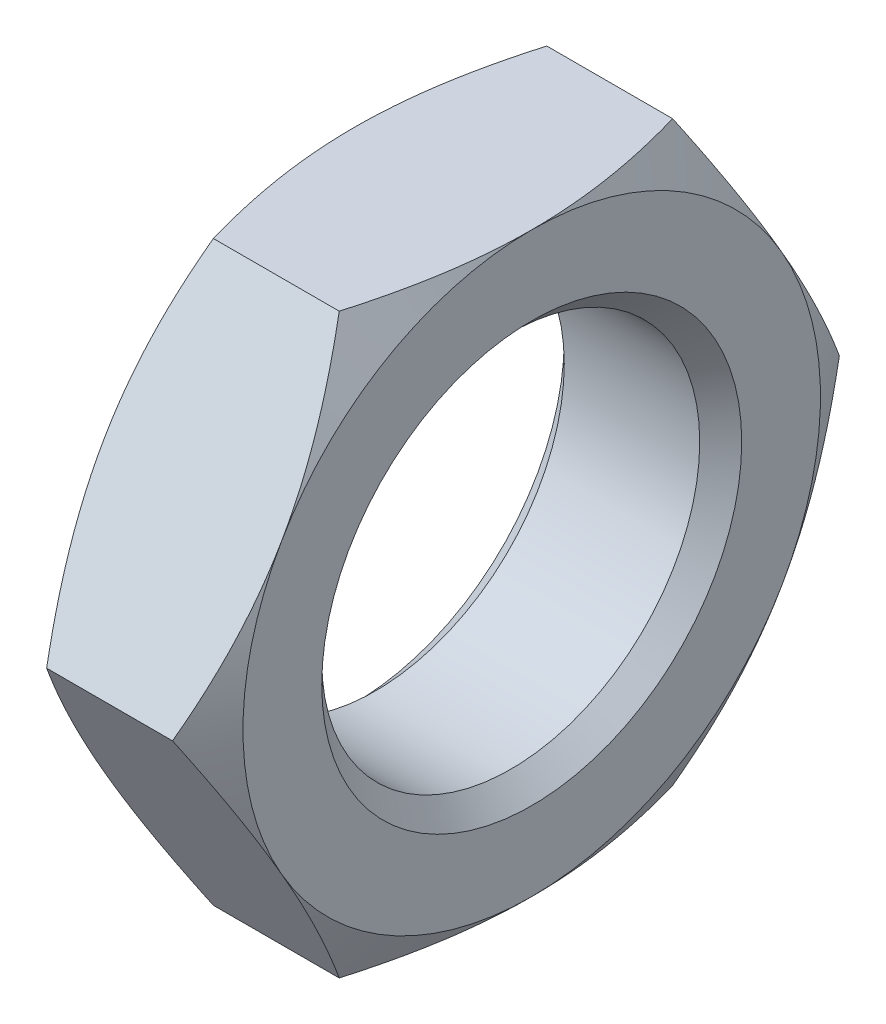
SolidWorks part; units mm, degrees
ref_plane "Front Plane" through (0, 0, 0) normal (0, 0, 1) x (1, 0, 0)
ref_plane "Top Plane" through (0, 0, 0) normal (0, 1, 0) x (1, 0, 0)
ref_plane "Right Plane" through (0, 0, 0) normal (1, 0, 0) x (0, 0, -1)
sketch "Sketch1" plane through (0, 0, 0) normal (1, 0, 0) x (0, 0, -1)
  line L1 (15.8771, 27.5) -> (-15.8771, 27.5)
  line L2 (-15.8771, 27.5) -> (-31.7543, 0)
  line L3 (-31.7543, 0) -> (-15.8771, -27.5)
  line L4 (-15.8771, -27.5) -> (15.8771, -27.5)
  line L5 (15.8771, -27.5) -> (31.7543, 0)
  line L6 (31.7543, 0) -> (15.8771, 27.5)
  circle A0 centre (0, 0) radius 27.5 construction
  circle A1 centre (0, 0) radius 18
extrude "Extrude1" add sketch "Sketch1" along normal blind 16.9
sketch "Sketch2" plane through (0, 0, 0) normal (0, 0, 1) x (1, 0, 0)
  line L0 (16.9, 27.5) -> (16.9, 110)
  line L1 (16.9, 110) -> (0, 110)
  line L2 (0, 110) -> (0, 27.5)
  line L3 (0, 27.5) -> (8.45, 42.1358)
  line L4 (8.45, 42.1358) -> (16.9, 27.5)
revolve "Cut-Revolve1" cut sketch "Sketch2" angle 360 about axis through (16.9, 0, 0) along (-1, 0, 0)
chamfer "Chamfer1" distance 2 angle 45 2 edges at (0, 0, -18) (16.9, 0, -18)
equation "\"D2@Sketch2\"=\"D1@Sketch1\"*2"
